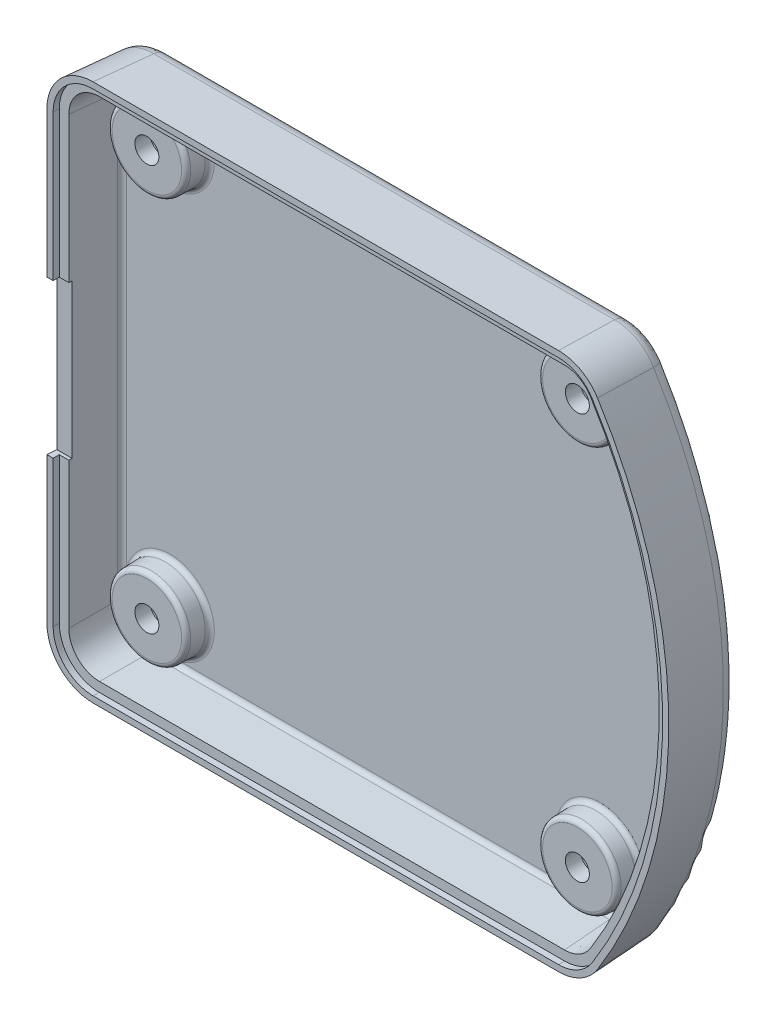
SolidWorks part; units mm, degrees
ref_plane "Front" through (0, 0, 0) normal (0, 0, 1) x (1, 0, 0)
ref_plane "Top" through (0, 0, 0) normal (0, 1, 0) x (1, 0, 0)
ref_plane "Right" through (0, 0, 0) normal (1, 0, 0) x (0, 0, -1)
sketch "Sketch1" plane through (0, 0, 0) normal (0, 0, 1) x (1, 0, 0)
  line L0 (0, 0) -> (0, 87.63)
  line L1 (0, 87.63) -> (87.63, 87.63)
  line L2 (0, 0) -> (87.63, 0)
  arc A0 (87.63, 87.63) -> (87.63, 0) centre (25.2867, 43.815) cw
  dimension "D3" = 76.2
  dimension "D1" = 87.63
  dimension "D2" = 87.63
extrude "Boss-Extrude1" add sketch "Sketch1" along normal blind 11.938 draft 3
fillet "Fillet1" radius 7.62 4 edges at (-0.3128, 87.9428, 5.969) (-0.3128, -0.3128, 5.969)
fillet "Fillet2" radius 2.54 8 edges at (86.062, 87.2012, 0) (101.4867, 43.815, 0) (88.3125, 1.6798, 0) (45.5764, 0, 0) (2.2275, 2.2275, 0) (0, 43.815, 0) (2.2275, 85.4025, 0) (45.5764, 87.63, 0)
shell "Shell1" thickness 2.54
sketch "Sketch2" plane through (0, 0, 2.54) normal (0, 0, 1) x (1, 0, 0)
  line L0 (-0.6256, 80.6461) -> (-0.6256, 6.9839) construction
  line L1 (83.8899, 88.2556) -> (6.9839, 88.2556) construction
  line L2 (6.9839, -0.6256) -> (83.8899, -0.6256) construction
  circle A0 centre (10.2964, 77.3336) radius 6.604
  circle A1 centre (81.4164, 77.3336) radius 6.604
  circle A2 centre (10.2964, 10.2964) radius 6.604
  circle A3 centre (81.4164, 10.2964) radius 6.604
  dimension "D5" = 13.208
  dimension "D1" = 10.922
  dimension "D2" = 10.922
  dimension "D3" = 10.922
  dimension "D4" = 71.12
extrude "Boss-Extrude2" add sketch "Sketch2" along normal blind 3.81 draft 2
sketch "Sketch3" plane through (0, 0, 11.938) normal (0, 0, 1) x (1, 0, 0)
  line L0 (1.9178, 80.6391) -> (1.9178, 6.9909) construction
  line L1 (6.9909, 1.9178) -> (83.8861, 1.9178) construction
  line L2 (83.8861, 85.7122) -> (6.9909, 85.7122) construction
  line L3 (1.9178, 80.6391) -> (1.9178, 6.9909) construction
  line L4 (6.9909, 1.9178) -> (83.8861, 1.9178) construction
  line L5 (83.8861, 85.7122) -> (6.9909, 85.7122) construction
  line L6 (83.8861, 87.2362) -> (6.9909, 87.2362)
  line L7 (0.3938, 80.6391) -> (0.3938, 6.9909)
  line L8 (6.9909, 0.3938) -> (83.8861, 0.3938)
  line L9 (83.8861, 84.4422) -> (6.9909, 84.4422)
  line L10 (3.1878, 80.6391) -> (3.1878, 6.9909)
  line L11 (6.9909, 3.1878) -> (83.8861, 3.1878)
  arc A0 (88.1814, 4.2917) -> (88.1814, 83.3383) centre (25.2867, 43.815) ccw construction
  arc A1 (88.1814, 4.2917) -> (88.1814, 83.3383) centre (25.2867, 43.815) ccw construction
  arc A2 (89.4718, 3.4808) -> (89.4718, 84.1492) centre (25.2867, 43.815) ccw
  arc A3 (87.1061, 4.9674) -> (87.1061, 82.6626) centre (25.2867, 43.815) ccw
  ellipse E0 centre (7.0048, 7.0048) end of major axis (10.6068, 10.6068) minor radius 5.08 (1.9178, 6.9909) -> (6.9909, 1.9178) ccw construction
  ellipse E1 centre (7.0048, 80.6252) end of major axis (10.6068, 77.0232) minor radius 5.08 (6.9909, 85.7122) -> (1.9178, 80.6391) ccw construction
  ellipse E2 centre (7.0048, 7.0048) end of major axis (10.6068, 10.6068) minor radius 5.08 (1.9178, 6.9909) -> (6.9909, 1.9178) ccw construction
  ellipse E3 centre (7.0048, 80.6252) end of major axis (10.6068, 77.0232) minor radius 5.08 (6.9909, 85.7122) -> (1.9178, 80.6391) ccw construction
  spline S0 degree 3 poles (-352.9427, 1952.938) (-42.4044, 336.2998) (51.3055, -6.638) (85.3581, 2.1313) (85.5637, 2.1983) (85.9616, 2.3568) (86.3463, 2.539) (86.7053, 2.7677) (87.0511, 3.0203) (87.2173, 3.1587) (112.904, 27.459) (-130.76, 291.7886) (-1332.5102, 1410.9211) knots -20.245108 -20.245108 -20.245108 -20.245108 0.25 0.25 0.375 0.375 0.5 0.625 0.625 0.75 0.75 21.353867 21.353867 21.353867 21.353867 only from (83.8861, 1.9178) to (88.1814, 4.2917) construction
  spline S1 degree 3 poles (-1331.3243, -1324.6049) (-127.7442, -201.5063) (112.7608, 60.3047) (87.2175, 84.4711) (87.0513, 84.6095) (86.7055, 84.8622) (86.3465, 85.0909) (85.9618, 85.2732) (85.564, 85.4315) (85.3583, 85.4986) (51.1156, 94.3183) (-43.0484, -252.6452) (-351.2137, -1865.6879) knots -20.245101 -20.245101 -20.245101 -20.245101 0.25 0.25 0.375 0.375 0.5 0.625 0.625 0.75 0.75 21.354193 21.354193 21.354193 21.354193 only from (88.1814, 83.3383) to (83.8861, 85.7122) construction
  spline S2 degree 3 poles (83.8861, 1.9178) (84.317, 1.9178) (84.7388, 1.9718) (85.3581, 2.1313) (85.5637, 2.1983) (85.9616, 2.3568) (86.3463, 2.539) (86.7053, 2.7677) (87.0511, 3.0203) (87.2173, 3.1587) (87.682, 3.5983) (87.9521, 3.9268) (88.1814, 4.2917) knots 0 0 0 0 0.25 0.25 0.375 0.375 0.5 0.625 0.625 0.75 0.75 1 1 1 1 construction
  spline S3 degree 3 poles (88.1814, 83.3383) (87.9521, 83.7032) (87.682, 84.0316) (87.2175, 84.4711) (87.0513, 84.6095) (86.7055, 84.8622) (86.3465, 85.0909) (85.9618, 85.2732) (85.564, 85.4315) (85.3583, 85.4986) (84.7389, 85.6582) (84.317, 85.7122) (83.8861, 85.7122) knots 0 0 0 0 0.25 0.25 0.375 0.375 0.5 0.625 0.625 0.75 0.75 1 1 1 1 construction
  spline S4 degree 1 poles (89.4718, 84.1492) (83.8861, 87.2362) knots 0 0 1 1 construction
  spline S5 degree 1 poles (6.9909, 87.2362) (0.3938, 80.6391) knots 0 0 1 1 construction
  spline S6 degree 1 poles (0.3938, 6.9909) (6.9909, 0.3938) knots 0 0 1 1 construction
  spline S7 degree 1 poles (83.8861, 0.3938) (89.4718, 3.4808) knots 0 0 1 1 construction
  spline S8 degree 3 poles (89.4718, 84.1492) (88.8873, 85.0793) (87.2185, 86.6686) (84.9846, 87.2362) (83.8861, 87.2362) knots 0 0 0 0 0.5 1 1 1 1
  spline S9 degree 3 poles (6.9909, 87.2362) (6.1327, 87.2362) (4.3973, 86.8933) (2.2044, 85.4256) (0.7367, 83.2327) (0.3938, 81.4973) (0.3938, 80.6391) knots 2.357564 2.357564 2.357564 2.357564 2.749578 3.141593 3.533607 3.925621 3.925621 3.925621 3.925621
  spline S10 degree 3 poles (0.3938, 6.9909) (0.3938, 6.1327) (0.7367, 4.3973) (2.2044, 2.2044) (4.3973, 0.7367) (6.1327, 0.3938) (6.9909, 0.3938) knots 2.357564 2.357564 2.357564 2.357564 2.749578 3.141593 3.533607 3.925621 3.925621 3.925621 3.925621
  spline S11 degree 3 poles (83.8861, 0.3938) (84.9845, 0.3938) (87.2182, 0.9612) (88.8873, 2.5507) (89.4718, 3.4808) knots 0 0 0 0 0.5 1 1 1 1
  spline S12 degree 1 poles (87.1061, 82.6626) (83.8861, 84.4422) knots 0 0 1 1 construction
  spline S13 degree 1 poles (6.9909, 84.4422) (3.1878, 80.6391) knots 0 0 1 1 construction
  spline S14 degree 1 poles (3.1878, 6.9909) (6.9909, 3.1878) knots 0 0 1 1 construction
  spline S15 degree 1 poles (83.8861, 3.1878) (87.1061, 4.9674) knots 0 0 1 1 construction
  spline S16 degree 3 poles (87.1061, 82.6626) (86.7692, 83.1988) (85.8072, 84.1151) (84.5194, 84.4422) (83.8861, 84.4422) knots 0 0 0 0 0.5 1 1 1 1
  spline S17 degree 3 poles (6.9909, 84.4422) (6.4958, 84.4422) (5.4942, 84.2443) (4.2313, 83.3987) (3.3857, 82.1358) (3.1878, 81.1342) (3.1878, 80.6391) knots 2.357564 2.357564 2.357564 2.357564 2.749578 3.141593 3.533607 3.925621 3.925621 3.925621 3.925621
  spline S18 degree 3 poles (3.1878, 6.9909) (3.1878, 6.4958) (3.3857, 5.4942) (4.2313, 4.2313) (5.4942, 3.3857) (6.4958, 3.1878) (6.9909, 3.1878) knots 2.357564 2.357564 2.357564 2.357564 2.749578 3.141593 3.533607 3.925621 3.925621 3.925621 3.925621
  spline S19 degree 3 poles (83.8861, 3.1878) (84.5193, 3.1878) (85.807, 3.5148) (86.7692, 4.4312) (87.1061, 4.9674) knots 0 0 0 0 0.5 1 1 1 1
  dimension "D1" = 1.524
  dimension "D2" = 1.27
sketch "Sketch4" plane through (0, 0, 6.35) normal (0, 0, 1) x (1, 0, 0)
  circle A0 centre (81.4164, 10.2964) radius 1.9812
  circle A1 centre (10.2964, 10.2964) radius 1.9812
  circle A2 centre (81.4164, 77.3336) radius 1.9812
  circle A3 centre (10.2964, 77.3336) radius 1.9812
  dimension "D1" = 3.9624
extrude "Cut-Extrude1" cut sketch "Sketch4" against normal blind 10.16
fillet "Fillet3" radius 0.762 16 edges at (86.7887, 3.527, 2.54) (99.0763, 43.815, 2.54) (86.7888, 84.103, 2.54) (45.5483, 85.2196, 2.54) (3.8954, 83.7346, 2.54) (2.4104, 43.815, 2.54) (3.8954, 3.8954, 2.54) (74.8124, 77.3336, 2.54) (3.6924, 77.3336, 2.54) (3.6924, 10.2964, 2.54) (74.8124, 10.2964, 2.54) (45.5483, 2.4104, 2.54) (87.8873, 10.2964, 6.35) (16.7673, 10.2964, 6.35) (87.8873, 77.3336, 6.35) (16.7673, 77.3336, 6.35)
sketch "Sketch5" plane through (0, 0, 0) normal (0, 0, -1) x (-1, 0, 0)
  line L0 (-83.8899, 88.2556) -> (-6.9839, 88.2556) construction
  line L1 (-22.2344, 10.2776) -> (-43.3164, 10.2776)
  line L2 (-19.6944, 12.8176) -> (-19.6944, 74.7936)
  line L3 (-22.2344, 77.3336) -> (-43.3164, 77.3336)
  line L4 (-45.8564, 12.8176) -> (-45.8564, 74.7936)
  line L5 (0.6256, 80.6461) -> (0.6256, 6.9839) construction
  arc A0 (-19.6944, 12.8176) -> (-22.2344, 10.2776) centre (-22.2344, 12.8176) cw
  arc A1 (-43.3164, 10.2776) -> (-45.8564, 12.8176) centre (-43.3164, 12.8176) cw
  arc A2 (-19.6944, 74.7936) -> (-22.2344, 77.3336) centre (-22.2344, 74.7936) ccw
  arc A3 (-43.3164, 77.3336) -> (-45.8564, 74.7936) centre (-43.3164, 74.7936) ccw
  point P16 (-19.6944, 77.3336)
  point P19 (-45.8564, 77.3336)
  dimension "D5" = 2.54
  dimension "D1" = 10.922
  dimension "D2" = 20.32
  dimension "D3" = 67.056
  dimension "D4" = 26.162
extrude "Cut-Extrude2" cut sketch "Sketch5" against normal blind 0.2032
extrude "Cut-Extrude3" cut sketch "Sketch3" against normal blind 1.016
sketch "Sketch6" plane through (0, 0, 2.54) normal (0, 0, 1) x (1, 0, 0)
  line L0 (6.9839, -0.6256) -> (83.8899, -0.6256) construction
  line L1 (-0.6256, 80.6461) -> (-0.6256, 6.9839) construction
  circle A0 centre (47.6344, 43.8244) radius 41.275 construction
  dimension "D1" = 82.55
  dimension "D2" = 44.45
  dimension "D3" = 48.26
sketch "Sketch7" plane through (0, 0, 0) normal (0, 0, -1) x (-1, 0, 0)
  circle A0 centre (-81.4164, 77.3336) radius 4.445
  circle A1 centre (-10.2964, 77.3336) radius 4.445
  circle A2 centre (-81.4164, 10.2964) radius 4.445
  circle A3 centre (-10.2964, 10.2964) radius 4.445
  dimension "D1" = 8.89
extrude "Cut-Extrude4" cut sketch "Sketch7" against normal blind 3.81 draft 2
sketch "Sketch8" plane through (0, 0, 0) normal (1, 0, 0) x (0, 0, -1)
  line L0 (0, 7.4834) -> (0, 80.1466) construction
  line L1 (-10.4, 56.5056) -> (-15, 56.5056)
  line L2 (-10.4, 56.5056) -> (-10.4, 31.1056)
  line L3 (-10.4, 31.1056) -> (-15, 31.1056)
  line L4 (-15, 56.5056) -> (-15, 31.1056)
  dimension "D1" = 25.4
  dimension "D2" = 4.6
  dimension "D3" = 10.4
  dimension "D4" = 31.75
extrude "Cut-Extrude5" cut sketch "Sketch8" against normal mid plane 10.16
equation "\"D2@Sketch2\"=\"D1@Sketch2\""
equation "\"D3@Sketch2\"=\"D1@Sketch2\""
equation "\"D3@Sketch8\"=.5in - 2.3mm"
